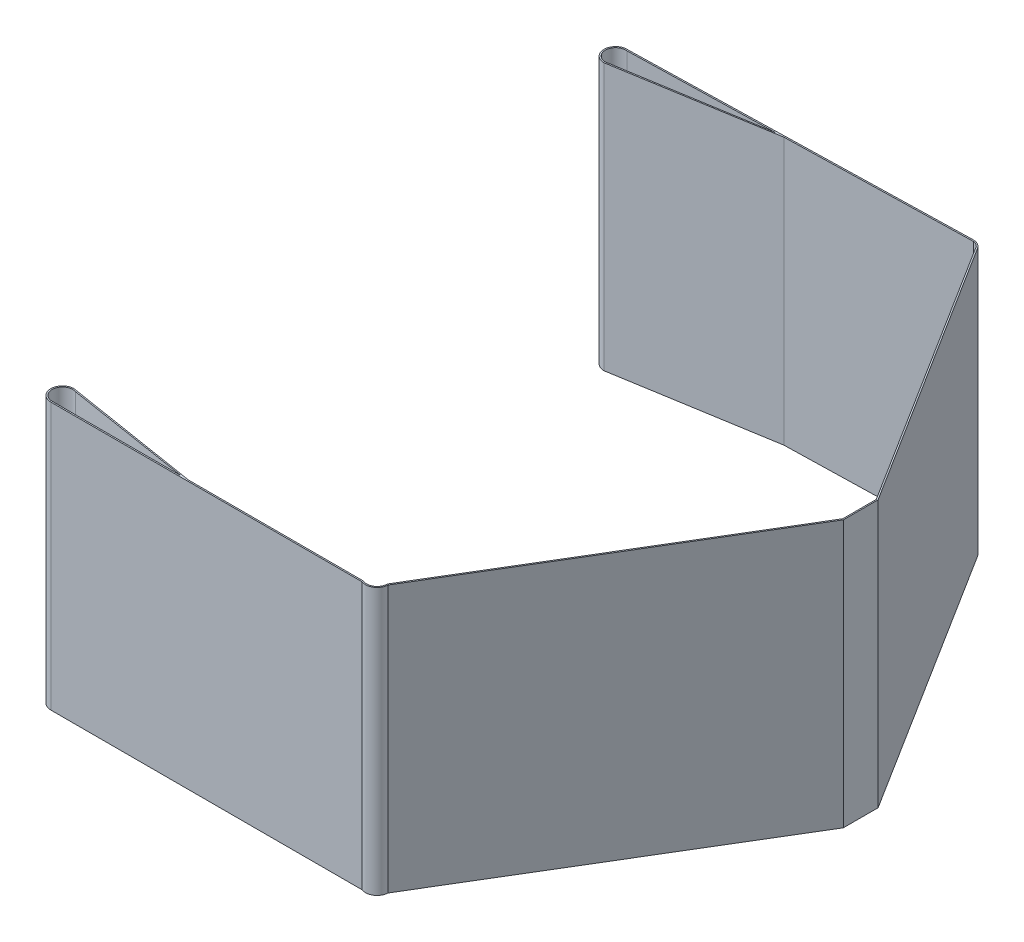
SolidWorks part; units mm, degrees
ref_plane "Plan de face" through (0, 0, 0) normal (0, 0, 1) x (1, 0, 0)
ref_plane "Plan de dessus" through (0, 0, 0) normal (0, 1, 0) x (1, 0, 0)
ref_plane "Plan de droite" through (0, 0, 0) normal (1, 0, 0) x (0, 0, -1)
sketch "Esquisse1" plane through (0, 0, 0) normal (0, 0, 1) x (1, 0, 0)
  line L1 (0, 390) -> (455, 390)
  line L2 (0, 390) -> (0, 0)
  line L3 (0, 0) -> (455, 0)
  line L4 (455, 390) -> (455, 0)
  dimension "D1" = 455
  dimension "D2" = 390
extrude "Extrusion1" add sketch "Esquisse1" along normal blind 2
sketch "Esquisse2" plane through (0, 390, 0) normal (0, 1, 0) x (1, 0, 0)
  line L0 (199.4278, 0) -> (189.0059, 0)
  line L1 (0, 32) -> (199.4278, 0)
  line L2 (455, 0) -> (0, 0) construction
  line L3 (4.676, 29.2526) -> (189.0059, 0)
  line L4 (0, 0) -> (0, -2)
  arc A0 (4.676, 29.2526) -> (0, 0) centre (0, 15) ccw
  arc A1 (0, 32) -> (0, -2) centre (0, 15) ccw
  dimension "D1" = 30
extrude "Extrusion2" add sketch "Esquisse2" against normal blind 390
sketch "Esquisse3" plane through (0, 390, 0) normal (0, 1, 0) x (1, 0, 0)
  line L0 (478.2227, 12.9586) -> (728.5239, 428.3793)
  line L1 (455, 0) -> (199.4278, 0) construction
  line L2 (476.4018, 13.8117) -> (726.703, 429.2324)
  line L3 (455, 0) -> (455, -2)
  line L4 (726.703, 429.2324) -> (728.5239, 428.3793)
  arc A0 (455, -2) -> (478.2227, 12.9586) centre (461.2442, 13.8117) ccw
  arc A1 (455, 0) -> (476.4018, 13.8117) centre (461.2442, 13.8117) ccw
  dimension "D3" = 34
  dimension "D5" = 485
  dimension "D1" = 485
  dimension "D2" = 121.07
  dimension "D4" = 2
extrude "Extrusion3" add sketch "Esquisse3" against normal blind 390
sketch "Esquisse4" plane through (0, 390, 0) normal (0, 1, 0) x (1, 0, 0)
  line L0 (479.4454, 871.784) -> (726.703, 478.2324)
  line L1 (726.703, 429.2324) -> (476.4018, 13.8117) construction
  line L2 (726.703, 429.2324) -> (726.703, 478.2324)
  line L3 (728.5239, 428.3793) -> (728.5239, 479.0935)
  line L4 (728.5239, 479.0935) -> (481.8074, 871.784)
  line L5 (479.4454, 871.784) -> (481.8074, 871.784)
  line L12 (455, 0) -> (199.4278, 0)
  line L13 (199.4278, 0) -> (0, 32)
  line L14 (0, -2) -> (455, -2)
  line L15 (478.2227, 12.9586) -> (728.5239, 428.3793)
  line L16 (728.5239, 428.3793) -> (726.703, 429.2324)
  line L17 (726.703, 429.2324) -> (476.4018, 13.8117)
  line L22 (728.5239, 428.3793) -> (726.703, 429.2324)
  arc A3 (0, 32) -> (0, -2) centre (0, 15) ccw
  arc A4 (455, -2) -> (478.2227, 12.9586) centre (461.2442, 13.8117) ccw
  arc A5 (455, 0) -> (476.4018, 13.8117) centre (461.2442, 13.8117) ccw
  dimension "D1" = 63.21
  dimension "D2" = 49
  dimension "D3" = 2
  dimension "D5" = 0
extrude "Extrusion4" add sketch "Esquisse4" against normal blind 390
sketch "Esquisse8" plane through (0, 390, 0) normal (0, 1, 0) x (1, 0, 0)
  line L0 (468.8645, 877.9018) -> (-23.4348, 865.9562)
  line L1 (-23.435, 863.9556) -> (471.2597, 875.9593)
  line L2 (479.4454, 871.784) -> (726.703, 478.2324) construction
  line L3 (-23.4348, 865.9562) -> (-23.435, 863.9556)
  line L4 (479.4454, 871.784) -> (481.8074, 871.784)
  arc A0 (481.8074, 871.784) -> (468.8645, 877.9018) centre (468.8645, 861.1518) ccw
  arc A1 (479.4454, 871.784) -> (471.2597, 875.9593) centre (468.8645, 861.1518) ccw
  dimension "D1" = 30
  dimension "D2" = 33.5
  dimension "D3" = 2
  dimension "D4" = 120.75
extrude "Extrusion7" add sketch "Esquisse8" against normal blind 390
sketch "Esquisse9" plane through (0, 390, 0) normal (0, 1, 0) x (1, 0, 0)
  line L0 (189.0059, 0) -> (189.0059, 869.1105) construction
  line L3 (-23.435, 863.9556) -> (471.2597, 875.9593) construction
  line L4 (-23.435, 863.9556) -> (-23.4348, 865.9562)
  line L5 (-25.2582, 834.0669) -> (189.0059, 869.1105)
  line L6 (-25.2582, 832.0793) -> (200.5954, 869.3917)
  line L7 (189.0059, 869.1105) -> (200.5954, 869.3917)
  arc A0 (-23.435, 863.9556) -> (-25.2582, 834.0669) centre (-25.2582, 849.0669) ccw
  arc A2 (-23.4348, 865.9562) -> (-25.2582, 832.0793) centre (-25.2582, 849.0669) ccw
  dimension "D1" = 30
extrude "Extrusion8" add sketch "Esquisse9" against normal blind 390
